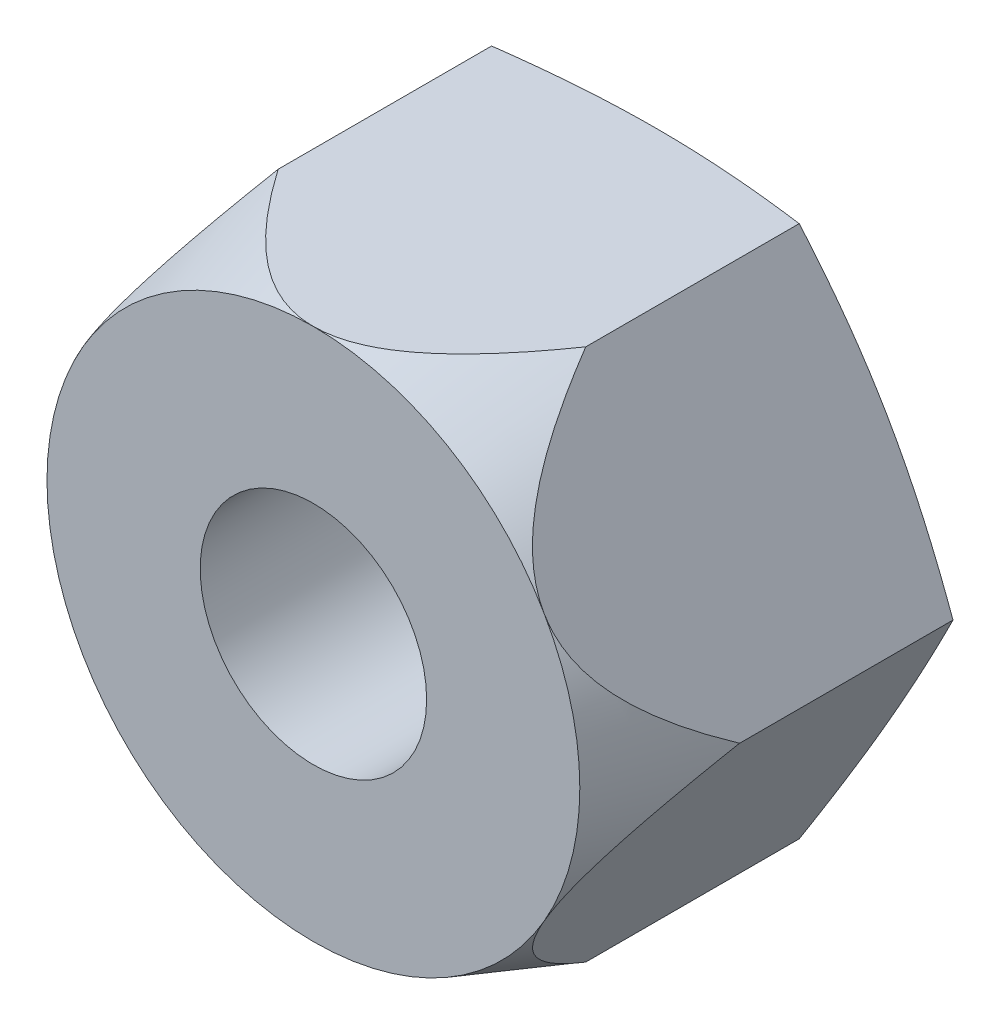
SolidWorks part; units mm, degrees
ref_plane "Front" through (0, 0, 0) normal (0, 0, 1) x (1, 0, 0)
ref_plane "Top" through (0, 0, 0) normal (0, 1, 0) x (1, 0, 0)
ref_plane "Right" through (0, 0, 0) normal (1, 0, 0) x (0, 0, -1)
sketch "Sketch1" plane through (0, 0, 0) normal (0, 0, 1) x (1, 0, 0)
  line L1 (2.3094, -4) -> (4.6188, 0)
  line L2 (4.6188, 0) -> (2.3094, 4)
  line L3 (2.3094, 4) -> (-2.3094, 4)
  line L4 (-2.3094, 4) -> (-4.6188, 0)
  line L5 (-4.6188, 0) -> (-2.3094, -4)
  line L6 (-2.3094, -4) -> (2.3094, -4)
  circle A0 centre (0, 0) radius 4 construction
  dimension "s" = 8
extrude "BaseNut" add sketch "Sketch1" against normal blind 5.3
sketch "Sketch2" plane through (0.4812, 0, -5.1) normal (0, -1, 0) x (0, 0, -1)
  line L0 (-0.1158, 4.1376) -> (0.2, 4.1376)
  line L2 (0.2, 4.1376) -> (0.2, 2.9588)
  line L3 (-5.1, 1.8282) -> (-5.1, 4.1376) construction
  line L4 (0.2, 2.9588) -> (-0.1158, 4.1376)
  line L5 (-5.1, 4.1376) -> (-3.32, 4.1376)
  line L6 (-5.1, 4.1376) -> (-5.1, 3.5188)
  line L7 (0.2, 1.8282) -> (0.2, 4.1376) construction
  line L8 (-5.1, 3.5188) -> (-3.32, 4.1376)
  line L9 (-0.6371, -0.4812) -> (-5.5811, -0.4812) construction
  line L10 (0.2, 4.1376) -> (-5.1, 4.1376) construction
  dimension "e" = 8
  dimension "D" = 6.88
  dimension "m1" = 3.52
  dimension "D4" = 15
revolve "Double-Chamfer" cut sketch "Sketch2" angle 360 about L9
sketch "Sketch3" plane through (0, 0, 0) normal (0, 0, 1) x (1, 0, 0)
  circle A0 centre (0, 0) radius 1.7
  dimension "D1" = 3.4
extrude "Hole" cut sketch "Sketch3" against normal through all
chamfer "EndChamfer" distance 0.4857 angle 45 1 edges at (1.7, 0, -5.3)
sketch "Sketch4" plane through (0, 0, 0) normal (0, 1, 0) x (1, 0, 0)
  line L0 (0, 6.8088) -> (0, -0.7438) construction
  line L1 (1.4, 4.9643) -> (1.7, 4.9643)
  line L2 (1.7, 4.9643) -> (1.9598, 4.8143)
  line L3 (1.9598, 4.8143) -> (1.7, 4.6643)
  line L4 (1.7, 4.6643) -> (1.4, 4.6643)
  line L5 (1.4, 4.6643) -> (1.4, 4.9643)
  line L6 (-1.7, 4.8143) -> (1.7, 4.8143) construction
  dimension "D1" = 3.4
  dimension "D2" = 0.3
revolve "Cut-Revolve10" [suppressed] cut sketch "Sketch4" angle 360 about L0
pattern_linear "LPattern10" [suppressed] count 13 spacing 0.36 along (0, 0, 1)
equation "\"e@Sketch2\" = \"s@Sketch1\""
equation "\"D1@Sketch4\" = \"D1@Sketch3\""
equation "\"D2@Sketch4\" = (  \"D2@ThreadCosmetic1\" - \"D1@Sketch3\" )  / 2"
equation "\"D3@LPattern10\" = \"D2@Sketch4\" * 1.2"
equation "\"D1@LPattern10\" = (  \"h@BaseNut\"  - \"D1@EndChamfer\" ) / \"D3@LPattern10\" "
equation "\"D1@EndChamfer\" = \"D1@Sketch3\" / 7"
